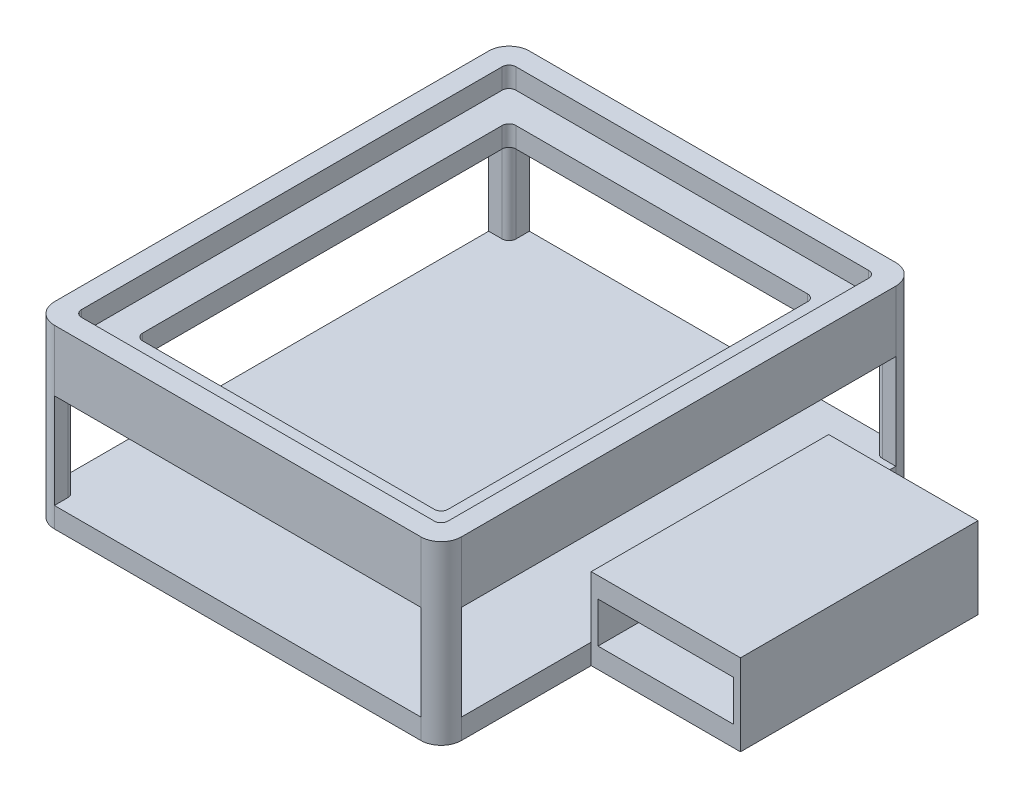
SolidWorks part; units mm, degrees
ref_plane "Front Plane" through (0, 0, 0) normal (0, 0, 1) x (1, 0, 0)
ref_plane "Top Plane" through (0, 0, 0) normal (0, 1, 0) x (1, 0, 0)
ref_plane "Right Plane" through (0, 0, 0) normal (1, 0, 0) x (0, 0, -1)
sketch "Sketch1" plane through (0, 0, 0) normal (0, 1, 0) x (1, 0, 0)
  line L1 (-34.1606, 13.8504) -> (25.8394, 13.8504)
  line L2 (-34.1606, 13.8504) -> (-34.1606, -56.1496)
  line L3 (-34.1606, -56.1496) -> (25.8394, -56.1496)
  line L4 (25.8394, 13.8504) -> (25.8394, -56.1496)
  dimension "D1" = 60
  dimension "D2" = 70
extrude "Boss-Extrude1" add sketch "Sketch1" along normal blind 3
sketch "Sketch3" plane through (0, 3, 0) normal (0, 1, 0) x (1, 0, 0)
  line L0 (-31.1606, 10.8504) -> (22.4181, 10.8504)
  line L1 (22.4181, 10.8504) -> (22.4181, -53.1496)
  line L2 (25.8394, 13.8504) -> (-34.1606, 13.8504) construction
  line L3 (25.8394, -56.1496) -> (25.8394, 13.8504) construction
  line L4 (-31.1606, 10.8504) -> (-31.1606, -53.1496)
  line L5 (-31.1606, -53.1496) -> (22.4181, -53.1496)
  line L9 (-34.1606, 13.8504) -> (25.8394, 13.8504)
  line L10 (-34.1606, 13.8504) -> (-34.1606, -56.1496)
  line L11 (-34.1606, -56.1496) -> (25.8394, -56.1496)
  line L12 (25.8394, 13.8504) -> (25.8394, -56.1496)
extrude "Boss-Extrude2" add sketch "Sketch3" along normal blind 17
sketch "Sketch4" plane through (0, 0, 56.1496) normal (0, 0, 1) x (1, 0, 0)
  line L0 (-34.1606, 20) -> (-34.1606, 0) construction
  line L1 (-31.1606, 17) -> (22.8394, 17)
  line L2 (-31.1606, 17) -> (-31.1606, 3)
  line L3 (-31.1606, 3) -> (22.8394, 3)
  line L4 (22.8394, 17) -> (22.8394, 3)
  line L5 (-34.1606, 20) -> (25.8394, 20) construction
  line L6 (25.8394, 20) -> (25.8394, 0) construction
  line L7 (-34.1606, 0) -> (25.8394, 0) construction
  dimension "D1" = 3
  dimension "D2" = 3
  dimension "D3" = 3
  dimension "D4" = 3
extrude "Cut-Extrude1" cut sketch "Sketch4" against normal blind 83
sketch "Sketch5" plane through (-34.1606, 0, 0) normal (-1, 0, 0) x (0, 0, 1)
  line L0 (-13.8504, 20) -> (56.1496, 20) construction
  line L1 (-10.8504, 17) -> (53.1496, 17)
  line L2 (-10.8504, 17) -> (-10.8504, 3)
  line L3 (-10.8504, 3) -> (53.1496, 3)
  line L4 (53.1496, 17) -> (53.1496, 3)
  line L5 (-13.8504, 20) -> (-13.8504, 0) construction
  line L6 (-13.8504, 0) -> (56.1496, 0) construction
  line L7 (56.1496, 20) -> (56.1496, 0) construction
  dimension "D1" = 3
  dimension "D2" = 3
  dimension "D3" = 3
  dimension "D4" = 3
extrude "Cut-Extrude2" cut sketch "Sketch5" against normal blind 83
sketch "Sketch6" plane through (0, 20, 0) normal (0, 1, 0) x (1, 0, 0)
  line L1 (25.8394, -56.1496) -> (-34.1606, -56.1496)
  line L2 (25.8394, -56.1496) -> (25.8394, 13.8504)
  line L3 (25.8394, 13.8504) -> (-34.1606, 13.8504)
  line L4 (-34.1606, -56.1496) -> (-34.1606, 13.8504)
extrude "Boss-Extrude3" add sketch "Sketch6" along normal blind 3
sketch "Sketch7" plane through (0, 23, 0) normal (0, 1, 0) x (1, 0, 0)
  line L0 (25.8394, 13.8504) -> (-34.1606, 13.8504) construction
  line L1 (-26.6606, 6.3504) -> (18.3394, 6.3504)
  line L2 (-26.6606, 6.3504) -> (-26.6606, -48.6496)
  line L3 (-26.6606, -48.6496) -> (18.3394, -48.6496)
  line L4 (18.3394, 6.3504) -> (18.3394, -48.6496)
  line L7 (-34.1606, 13.8504) -> (-34.1606, -56.1496) construction
  dimension "D1" = 45
  dimension "D2" = 55
  dimension "D3" = 60
  dimension "D4" = 7.5
  dimension "D5" = 7.5
extrude "Cut-Extrude3" cut sketch "Sketch7" against normal blind 7.5
sketch "Sketch9" plane through (0, 23, 0) normal (0, 1, 0) x (1, 0, 0)
  line L1 (25.8394, -56.1496) -> (-34.1606, -56.1496)
  line L2 (25.8394, -56.1496) -> (25.8394, 13.8504)
  line L3 (25.8394, 13.8504) -> (-34.1606, 13.8504)
  line L4 (-34.1606, -56.1496) -> (-34.1606, 13.8504)
  line L5 (18.3394, -48.6496) -> (-26.6606, -48.6496)
  line L6 (18.3394, -48.6496) -> (18.3394, 6.3504)
  line L7 (18.3394, 6.3504) -> (-26.6606, 6.3504)
  line L8 (-26.6606, -48.6496) -> (-26.6606, 6.3504)
  line L9 (-31.1606, 10.8504) -> (22.8394, 10.8504)
  line L10 (-31.1606, 10.8504) -> (-31.1606, -53.1496)
  line L11 (-31.1606, -53.1496) -> (22.8394, -53.1496)
  line L12 (22.8394, 10.8504) -> (22.8394, -53.1496)
  dimension "D1" = 3
  dimension "D2" = 3
  dimension "D3" = 3
  dimension "D4" = 3
extrude "Boss-Extrude4" add sketch "Sketch9" along normal blind 3 contours L9 L12 L11 L10 M18 M15 M16 M17
fillet "Fillet3" radius 3 1 edges at (-34.1606, 13, 56.1496)
fillet "Fillet4" radius 3 1 edges at (25.8394, 13, 56.1496)
fillet "Fillet5" radius 3 1 edges at (-34.1606, 13, -13.8504)
fillet "Fillet6" radius 3 1 edges at (25.8394, 13, -13.8504)
fillet "Fillet7" radius 1 1 edges at (-26.6606, 21.5, -6.3504)
fillet "Fillet8" radius 1 2 edges at (22.8394, 24.5, -10.8504) (18.3394, 21.5, -6.3504)
fillet "Fillet9" radius 1 5 edges at (-31.1606, 24.5, -10.8504) (18.3394, 21.5, 48.6496) (22.8394, 24.5, 53.1496) (-31.1606, 24.5, 53.1496) (-26.6606, 21.5, 48.6496)
fillet "Fillet10" radius 1 1 edges at (-31.1606, 10, -10.8504)
fillet "Fillet11" radius 1 3 edges at (-31.1606, 10, 53.1496) (22.8394, 10, -10.8504) (22.8394, 10, 53.1496)
sketch "Sketch10" plane through (0, 0, 0) normal (0, -1, 0) x (1, 0, 0)
  line L0 (25.8394, 53.1496) -> (25.8394, -10.8504) construction
  line L1 (25.8394, 34.0399) -> (47.8394, 34.0399)
  line L2 (25.8394, 34.0399) -> (25.8394, -0.9601)
  line L3 (25.8394, -0.9601) -> (47.8394, -0.9601)
  line L4 (47.8394, 34.0399) -> (47.8394, -0.9601)
  dimension "D1" = 35
  dimension "D2" = 22
extrude "Boss-Extrude6" add sketch "Sketch10" against normal blind 3
sketch "Sketch11" plane through (0, 3, 0) normal (0, 1, 0) x (1, 0, 0)
  line L0 (25.8394, -53.1496) -> (25.8394, 10.8504) construction
  line L1 (47.8394, 0.9601) -> (25.8394, 0.9601)
  line L2 (47.8394, 0.9601) -> (47.8394, -34.0399)
  line L3 (47.8394, -34.0399) -> (25.8394, -34.0399)
  line L4 (25.8394, 0.9601) -> (25.8394, -34.0399)
  line L5 (47.8394, -34.0399) -> (25.8394, -34.0399) construction
extrude "Boss-Extrude7" add sketch "Sketch11" along normal blind 9
sketch "Sketch13" plane through (0, 0, 34.0399) normal (0, 0, 1) x (1, 0, 0)
  line L0 (47.8394, 0) -> (25.8394, 0) construction
  line L1 (26.8394, 9) -> (46.8394, 9)
  line L2 (26.8394, 9) -> (26.8394, 3)
  line L3 (26.8394, 3) -> (46.8394, 3)
  line L4 (46.8394, 9) -> (46.8394, 3)
  line L5 (47.8394, 12) -> (47.8394, 0) construction
  line L6 (25.8394, 12) -> (25.8394, 3) construction
  point P10 (26.8394, 6)
  dimension "D1" = 3
  dimension "D2" = 6
  dimension "D3" = 1
  dimension "D4" = 1
extrude "Cut-Extrude4" cut sketch "Sketch13" against normal blind 32
